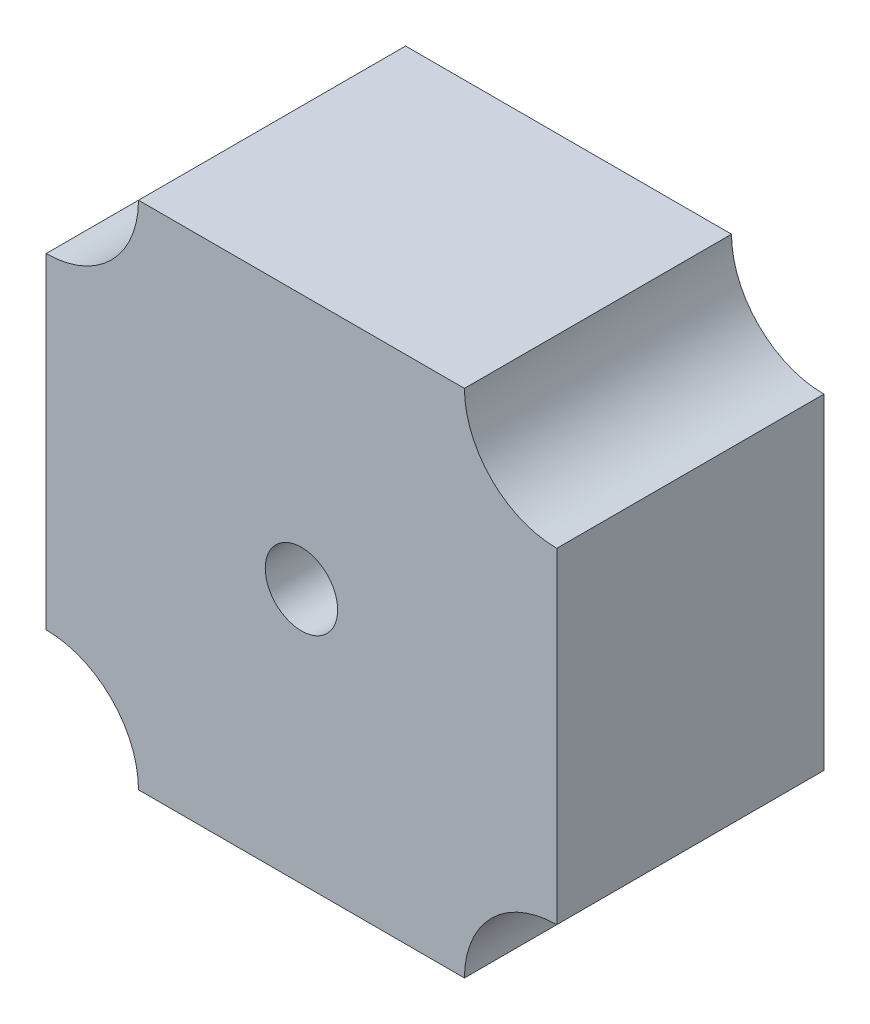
SolidWorks part; units mm, degrees
ref_plane "前视" through (0, 0, 0) normal (0, 0, 1) x (1, 0, 0)
ref_plane "上视" through (0, 0, 0) normal (0, 1, 0) x (1, 0, 0)
ref_plane "右视" through (0, 0, 0) normal (1, 0, 0) x (0, 0, -1)
sketch "草图1" plane through (0, 0, 0) normal (0, 0, 1) x (1, 0, 0)
  line L1 (18, -28.2) -> (-18, -28.2)
  line L2 (28.2, -18) -> (28.2, 18)
  line L3 (18, 28.2) -> (-18, 28.2)
  line L4 (-28.2, -18) -> (-28.2, 18)
  line L5 (28.2, -28.2) -> (-28.2, 28.2) construction
  line L6 (28.2, 28.2) -> (-28.2, -28.2) construction
  line L11 (18, -28.2) -> (-18, 28.2) construction
  line L12 (18, 28.2) -> (-18, -28.2) construction
  line L17 (28.2, -18) -> (-28.2, 18) construction
  line L18 (28.2, 18) -> (-28.2, -18) construction
  arc A0 (-28.2, 18) -> (-18, 28.2) centre (-28.2, 28.2) ccw
  arc A1 (18, 28.2) -> (28.2, 18) centre (28.2, 28.2) ccw
  arc A2 (28.2, -18) -> (18, -28.2) centre (28.2, -28.2) ccw
  arc A3 (-18, -28.2) -> (-28.2, -18) centre (-28.2, -28.2) ccw
  point P0 (0, 0)
  point P6 (0, 0)
  point P11 (0, 0)
  dimension "D1" = 56.4
  dimension "D2" = 56.4
  dimension "D3" = 36
  dimension "D4" = 36
extrude "凸台-拉伸1" add sketch "草图1" along normal blind 29.5
sketch "草图2" plane through (0, 0, 0) normal (0, 0, -1) x (-1, 0, 0)
  circle A0 centre (0, 0) radius 4
extrude "切除-拉伸1" cut sketch "草图2" against normal blind 29.5
